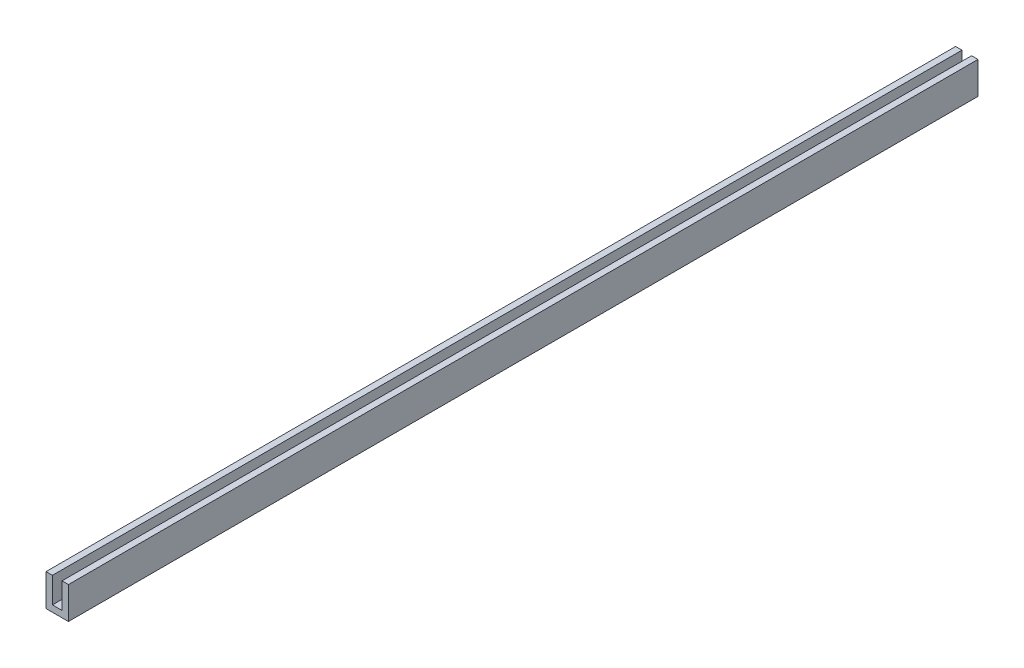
SolidWorks part; units mm, degrees
ref_plane "Plan de face" through (0, 0, 0) normal (0, 0, 1) x (1, 0, 0)
ref_plane "Plan de dessus" through (0, 0, 0) normal (0, 1, 0) x (1, 0, 0)
ref_plane "Plan de droite" through (0, 0, 0) normal (1, 0, 0) x (0, 0, -1)
sketch "Esquisse1" plane through (0, 0, 0) normal (0, 0, 1) x (1, 0, 0)
  line L1 (0, 0) -> (7, 0)
  line L2 (0, 0) -> (0, 10)
  line L3 (0, 10) -> (7, 10)
  line L4 (7, 0) -> (7, 10)
  dimension "D1" = 7
  dimension "D2" = 10
extrude "Extrusion1" add sketch "Esquisse1" along normal blind 284
sketch "Esquisse3" plane through (0, 0, 284) normal (0, 0, 1) x (1, 0, 0)
  line L0 (7, 10) -> (0, 10) construction
  line L1 (2, 10) -> (5, 10)
  line L2 (2, 10) -> (2, 2)
  line L3 (2, 2) -> (5, 2)
  line L4 (5, 10) -> (5, 2)
  line L5 (0, 10) -> (0, 0) construction
  line L6 (0, 0) -> (7, 0) construction
  dimension "D1" = 2
  dimension "D2" = 3
  dimension "D3" = 2
extrude "Enlèv. mat.-Extru.1" cut sketch "Esquisse3" against normal through all
